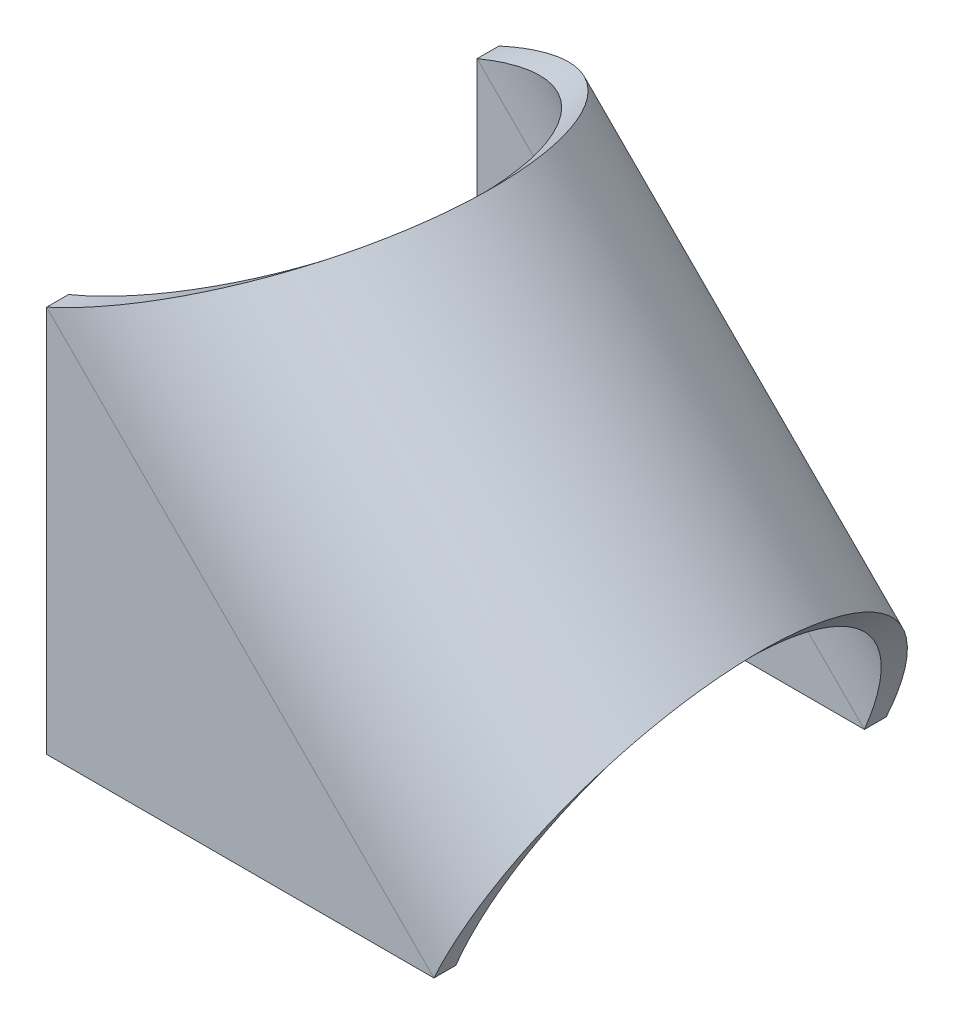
SolidWorks part; units mm, degrees
ref_plane "前视基准面" through (0, 0, 0) normal (0, 0, 1) x (1, 0, 0)
ref_plane "上视基准面" through (0, 0, 0) normal (0, 1, 0) x (1, 0, 0)
ref_plane "右视基准面" through (0, 0, 0) normal (1, 0, 0) x (0, 0, -1)
imported_body "基体零件-带补料的垂直四通管-1"
sheet metal parameters "钣金1" parameters "D1"=0.7366, "厚度"=1
bend "圆角折弯1" bend radius 9.3514 bend angle 180 parameters "D5"=1
flatten bends "展开-折弯1" parameters "D1"=0
sketch "尖角-草图1" plane through (0, 0, -9.3514) normal (0, 0, 1) x (1, 0, 0)
  line L0 (28.115, 10.3868) -> (10.3868, 28.115) construction
process bends "加工-折弯1" parameters "D1"=0
sketch "平面-草图1" plane through (0, 0, -9.3514) normal (0, 0, 1) x (1, 0, 0)
flat pattern "平板型式1"
sketch "折弯-线1" plane through (0, 0, 0) normal (0, 1, 0) x (-1, 0, 0)
bend of the flat pattern "展开-<圆角折弯1>1"
